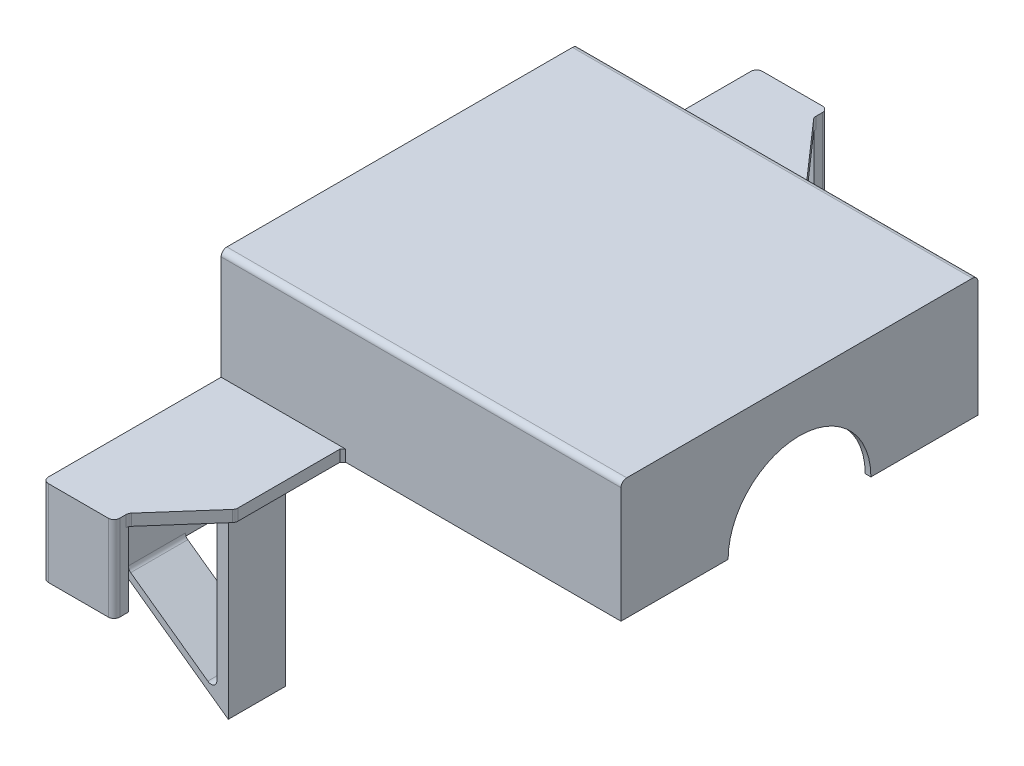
SolidWorks part; units mm, degrees
ref_plane "前视基准面" through (0, 0, 0) normal (0, 0, 1) x (1, 0, 0)
ref_plane "上视基准面" through (0, 0, 0) normal (0, 1, 0) x (1, 0, 0)
ref_plane "右视基准面" through (0, 0, 0) normal (1, 0, 0) x (0, 0, -1)
sketch "草图1" plane through (0, 0, 0) normal (0, 1, 0) x (1, 0, 0)
  line L1 (70, 62.5) -> (-70, 62.5)
  line L2 (70, 62.5) -> (70, -62.5)
  line L3 (70, -62.5) -> (-70, -62.5)
  line L4 (-70, 62.5) -> (-70, -62.5)
  line L5 (70, 62.5) -> (-70, -62.5) construction
  line L6 (70, -62.5) -> (-70, 62.5) construction
  point P0 (0, 0)
  dimension "D1" = 140
  dimension "D2" = 125
extrude "凸台-拉伸1" add sketch "草图1" along normal blind 42.5
shell "抽壳1" thickness 2
sketch "草图4" plane through (0, 0, 0) normal (0, -1, 0) x (1, 0, 0)
  line L0 (-70, 62.5) -> (-70, 120)
  line L1 (-70, 120) -> (-45, 120)
  line L2 (-45, 120) -> (-27.4, 100)
  line L3 (-27.4, 100) -> (-27.4, 62.5)
  line L4 (-70, 62.5) -> (70, 62.5) construction
  line L5 (-27.4, 62.5) -> (-70, 62.5)
  dimension "D1" = 57.5
  dimension "D2" = 42.6
  dimension "D3" = 37.5
  dimension "D4" = 25
extrude "凸台-拉伸2" add sketch "草图4" against normal blind 4
mirror "镜向1" about plane through (0, 0, 0) normal (0, 0, 1) of "凸台-拉伸2"
sketch "草图5" plane through (-70, 0, 0) normal (-1, 0, 0) x (0, 0, 1)
  line L3 (99, 0) -> (-99, 0)
  line L8 (99, 34) -> (-99, 34)
  line L9 (99, 34) -> (99, -34)
  line L10 (99, -34) -> (-99, -34)
  line L11 (-99, 34) -> (-99, -34)
  line L12 (99, 34) -> (-99, -34) construction
  line L13 (99, -34) -> (-99, 34) construction
  point P0 (0, 0)
  dimension "D1" = 68
  dimension "D2" = 198
extrude "凸台-拉伸4" add sketch "草图5" against normal blind 4 contours L11 L10 L9 M7
chamfer "倒角1" distance 1 angle 45 5 edges at (-68, 0, 0) (-68, 40.5, 0) (68, 40.5, 0) (-27.4, 2, -62.5) (-27.4, 2, 62.5)
fillet "圆角1" radius 2 2 edges at (0, 42.5, 62.5) (0, 42.5, -62.5)
sketch "草图6" plane through (0, 0, 99) normal (0, 0, 1) x (1, 0, 0)
  line L0 (-70, -34) -> (-66, -34)
  line L1 (-31, -59.2617) -> (-31, -62)
  line L2 (-70, -34) -> (-31, -62)
  line L3 (-66, -34) -> (-35, -56.2564)
  line L4 (-31, -59.2617) -> (-31, 0)
  line L5 (-31, 0) -> (-35, 0)
  line L6 (-35, 0) -> (-35, -56.2564)
  line L7 (-26.4, 0) -> (70, 0) construction
  dimension "D1" = 4
  dimension "D2" = 35
  dimension "D3" = 28
extrude "凸台-拉伸5" add sketch "草图6" against normal blind 20
sketch "草图7" plane through (-70, 0, 0) normal (-1, 0, 0) x (0, 0, 1)
  line L0 (-120, 4) -> (-120, -26)
  line L1 (-120, -26) -> (-125, -26)
  line L2 (-125, -26) -> (-125, 4)
  line L3 (-125, 4) -> (-120, 4)
  dimension "D1" = 5
  dimension "D2" = 30
extrude "凸台-拉伸6" add sketch "草图7" against normal blind 25
mirror "镜向2" about plane through (0, 0, 0) normal (0, 0, 1) of "凸台-拉伸6", "凸台-拉伸5"
fillet "圆角2" radius 2 12 edges at (-35, -56.2564, -89) (-66, -34, -89) (-35, -56.2564, 89) (-66, -34, 89) (-45, 2, -120) (-45, 2, 120) (-27.4, 2, 100) (-27.4, 2, -100) (-45, -11, -125) (-70, -11, -125) (-70, -11, 125) (-45, -11, 125)
sketch "草图8" plane through (70, 0, 0) normal (1, 0, 0) x (0, 0, -1)
  circle A0 centre (0, 0) radius 25
  dimension "D1" = 50
extrude "切除-拉伸1" cut sketch "草图8" against normal up to next
